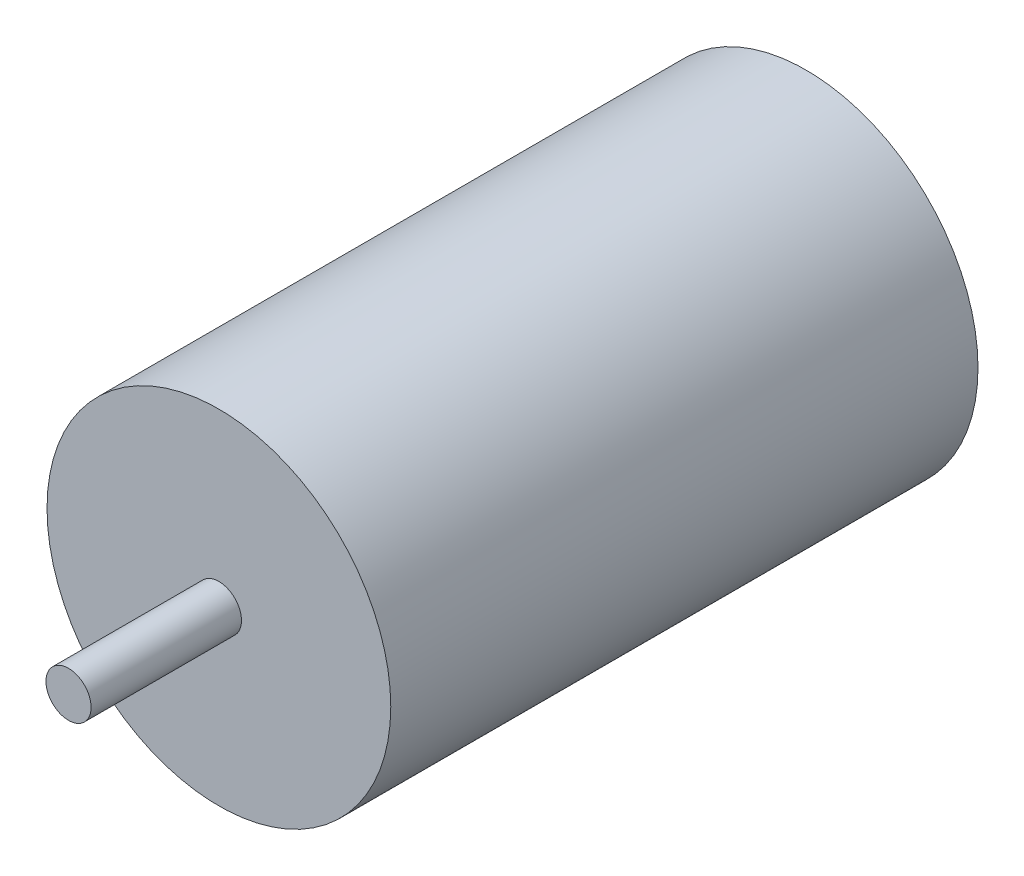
SolidWorks part; units mm, degrees
ref_plane "Front Plane" through (0, 0, 0) normal (0, 0, 1) x (1, 0, 0)
ref_plane "Top Plane" through (0, 0, 0) normal (0, 1, 0) x (1, 0, 0)
ref_plane "Right Plane" through (0, 0, 0) normal (1, 0, 0) x (0, 0, -1)
sketch "Sketch1" plane through (0, 0, 0) normal (0, 0, 1) x (1, 0, 0)
  circle A0 centre (0, 0) radius 30.48
  dimension "D1" = 60.96
extrude "Boss-Extrude1" add sketch "Sketch1" along normal blind 104.14
sketch "Sketch2" plane through (0, 0, 104.14) normal (0, 0, 1) x (1, 0, 0)
  circle A0 centre (0, 0) radius 4.0005
  dimension "D1" = 8.001
extrude "Boss-Extrude2" add sketch "Sketch2" along normal blind 26.67
